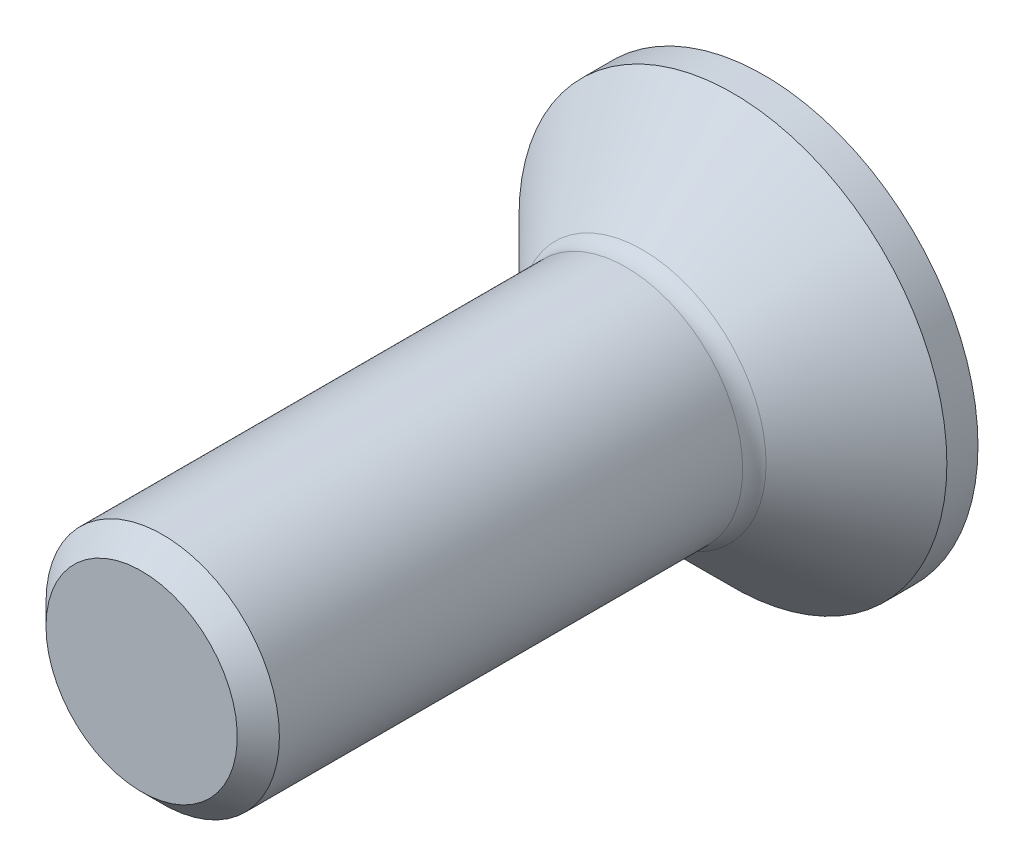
SolidWorks part; units mm, degrees
ref_plane "Plan1" through (0, 0, 0) normal (0, 0, 1) x (1, 0, 0)
ref_plane "Plan2" through (0, 0, 0) normal (0, 1, 0) x (1, 0, 0)
ref_plane "Plan3" through (0, 0, 0) normal (1, 0, 0) x (0, 0, -1)
sketch "Sketch1" plane through (0, 0, 0) normal (1, 0, 0) x (0, 0, -1)
  line L0 (0, 1.5) -> (1.65, 3.15)
  line L1 (1.65, 3.15) -> (1.65, 0)
  line L2 (0, 1.5) -> (-6.35, 1.5)
  line L3 (-6.35, 1.5) -> (-6.35, 0)
  line L4 (-6.35, 0) -> (1.65, 0) construction
  line L5 (-6.35, 0) -> (1.65, 0)
  line L6 (1.65, 0) -> (1.15, 0) construction
  dimension "D2" = 45
  dimension "K" = 1.65
  dimension "L" = 8
  dimension "D" = 3
  dimension "P" = 0.5
revolve "Base-Revolve" add sketch "Sketch1"
chamfer "Chamfer1" distance 0.2706 angle 45 1 edges at (1.5, 0, 6.35)
fillet "Fillet1" radius 0.3 1 edges at (1.5, 0, 0)
sketch "Sketch2" plane through (0, 0, -1.65) normal (0, 0, -1) x (-1, 0, 0)
  circle A0 centre (0, 0) radius 2.75
  circle A1 centre (0, 0) radius 3.15 construction
  dimension "DK" = 5.5
extrude "Cut-Extrude1" cut sketch "Sketch2" against normal through all flip side to cut
hole_wizard "Hole1" positions "Sketch4" profile "Sketch3" legacy
sketch "Sketch4" plane through (0, 0, -1.65) normal (0, 0, -1) x (-1, 0, 0)
  circle A0 centre (0, 0) radius 2.75 construction
  point P0 (0, 0)
sketch "Sketch3" plane through (0, 0, -1.65) normal (1, 0, 0) x (0, 1, 0)
  line L0 (0, 0) -> (0, 1.6274)
  line L1 (0, 1.6274) -> (1, 1.05)
  line L2 (1, 1.05) -> (1, 0)
  line L4 (1, 0) -> (0, 0)
  line L6 (0, 1.6274) -> (-1, 1.05) construction
  line L7 (0, -4.2442) -> (0, 117.3081) construction
  dimension "Diameter" = 2
  dimension "Depth" = 1.05
  dimension "Drill Angle" = 120
sketch "Sketch5" plane through (0, 0, -1.65) normal (0, 0, -1) x (-1, 0, 0)
  line L0 (-1.1547, 0) -> (1.1547, 0) construction
  line L1 (0, 1) -> (0, -1) construction
  line L2 (-0.5774, 1) -> (0.5774, 1)
  line L3 (0.5774, 1) -> (1.1547, 0)
  line L4 (1.1547, 0) -> (0.5774, -1)
  line L5 (0.5774, -1) -> (-0.5774, -1)
  line L6 (-0.5774, -1) -> (-1.1547, 0)
  line L7 (-1.1547, 0) -> (-0.5774, 1)
  circle A0 centre (0, 0) radius 1 construction
  dimension "D1" = 120
extrude "Cut-Extrude2" cut sketch "Sketch5" against normal blind 1.05
equation "\"D2@Cut-Extrude2\" = \"Depth@Sketch3\""
equation "\"D1@Cosmetic_Thread1\" = \"D@Sketch1\"-(1.0825*\"P@Sketch1\")"
equation "\"D1@Chamfer1\" = (\"D@Sketch1\"-\"D1@Cosmetic_Thread1\")/2"
